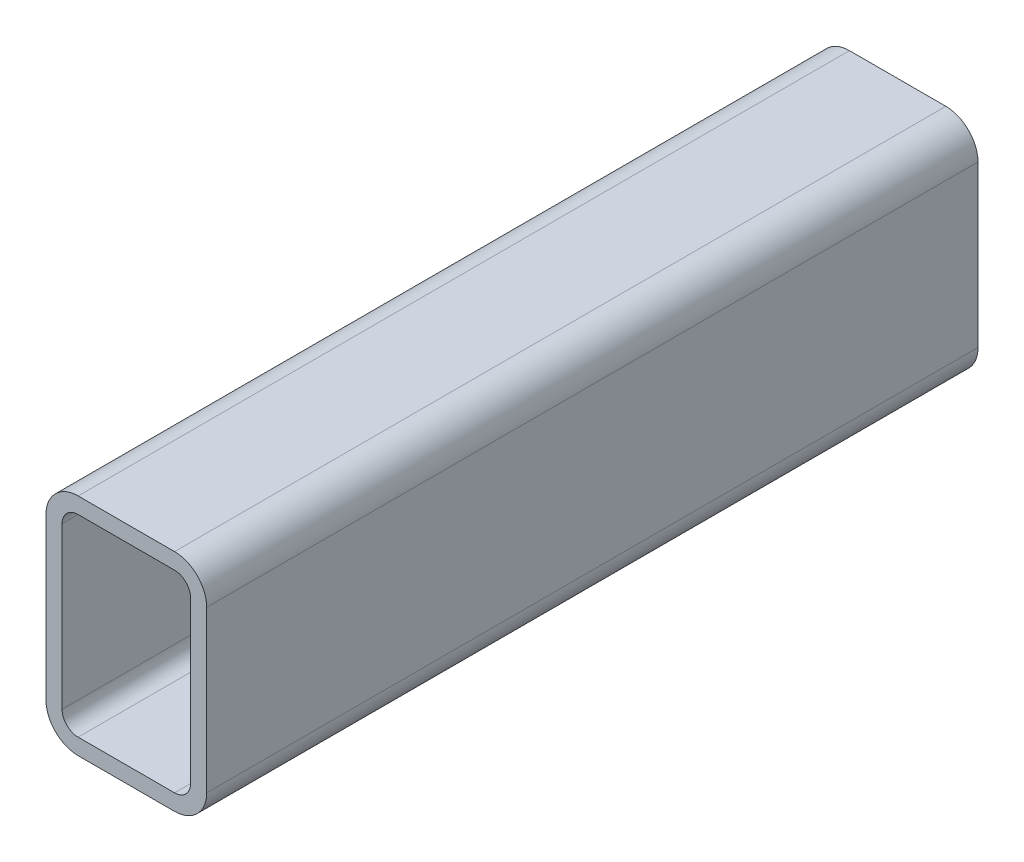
SolidWorks part; units mm, degrees
ref_plane "Front Plane" through (0, 0, 0) normal (0, 0, 1) x (1, 0, 0)
ref_plane "Top Plane" through (0, 0, 0) normal (0, 1, 0) x (1, 0, 0)
ref_plane "Right Plane" through (0, 0, 0) normal (1, 0, 0) x (0, 0, -1)
sketch "Sketch1" plane through (0, 0, 0) normal (0, 0, 1) x (1, 0, 0)
sketch_block_instance "HSS3.5x2.5x0.250-1"
sketch_block "HSS3.5x2.5x0.250"
extrude "Boss-Extrude1" add sketch "Sketch1" along normal blind 304.8
